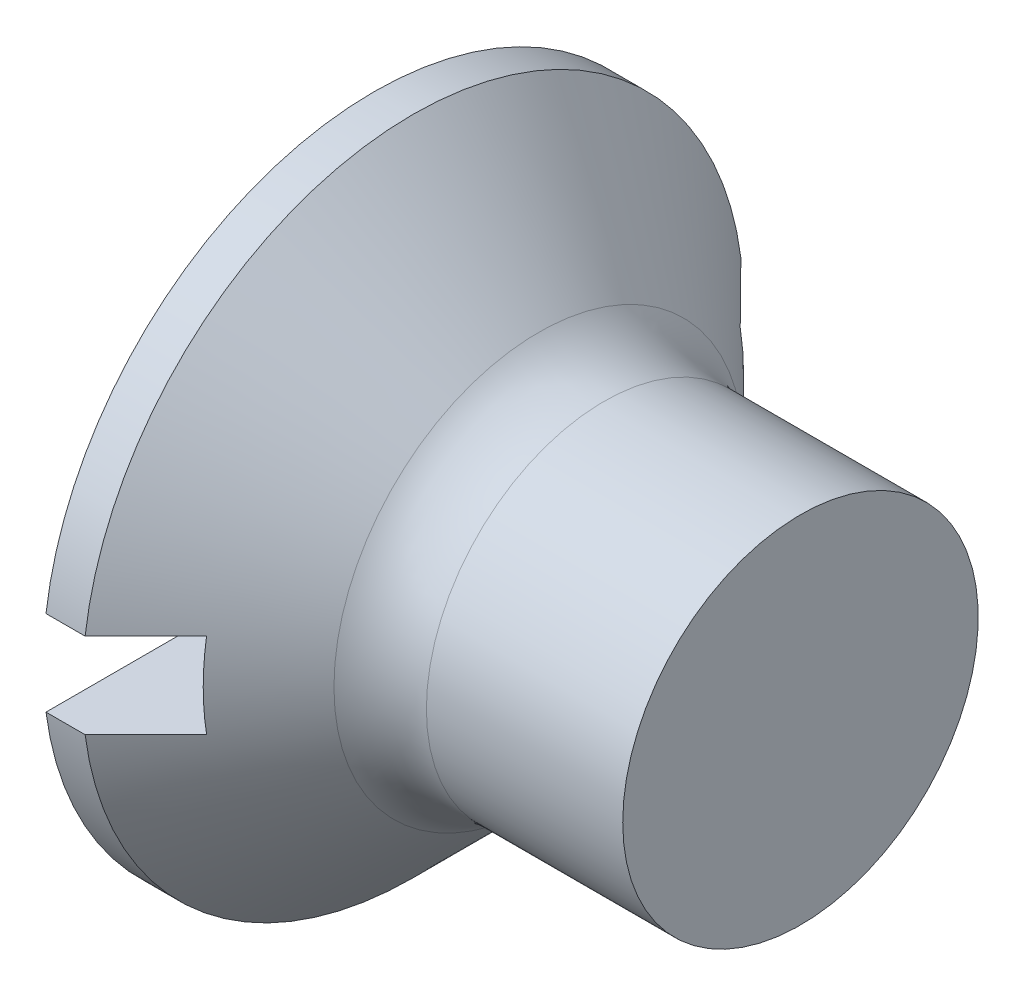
SolidWorks part; units mm, degrees
ref_plane "Plane1" through (0, 0, 0) normal (0, 0, 1) x (1, 0, 0)
ref_plane "Plane2" through (0, 0, 0) normal (0, 1, 0) x (1, 0, 0)
ref_plane "Plane3" through (0, 0, 0) normal (1, 0, 0) x (0, 0, -1)
sketch "BodySke" plane through (0, 0, 0) normal (0, 0, 1) x (1, 0, 0)
  line L0 (0, 0) -> (0, 4.65)
  line L1 (0, 4.65) -> (0.55, 4.65)
  line L2 (2.7, 2.5) -> (6, 2.5)
  line L3 (6, 2.5) -> (6, 0)
  line L4 (6, 0) -> (0, 0)
  line L5 (-6.35, 0) -> (82.55, 0) construction
  line L6 (2.7, -2.5) -> (6, -2.5) construction
  line L7 (0.55, -4.65) -> (2.7, -2.5) construction
  line L8 (0.55, 4.65) -> (2.7, 2.5)
  line L9 (0, -4.65) -> (0.55, -4.65) construction
  line L10 (3.5, 4.0875) -> (3.5, -5.4375) construction
  line L11 (-2, 6.35) -> (-2, -3.175) construction
  dimension "Diameter" = 5
  dimension "Length" = 6
  dimension "Head_ht" = 2.7
  dimension "Head_dia" = 9.3
  dimension "Head_ang" = 90
  dimension "D6" = 0.55
  dimension "Advance" = 0.8
  dimension "Thread_nom" = 8
revolve "Base-Revolve" add sketch "BodySke" angle 360 about L5
fillet "Fillet1" radius 1.3 1 edges at (2.7, 0, 2.5)
sketch "Sketch2" plane through (0, 0, 0) normal (-1, 0, 0) x (0, 0, 1)
  line L0 (-4.65, -0.6) -> (4.65, -0.6)
  line L1 (-4.65, -0.6) -> (-4.65, 0.6)
  line L2 (4.65, 0.6) -> (-4.65, 0.6)
  line L3 (4.65, 0.6) -> (4.65, -0.6)
  dimension "D1" = 0.6
  dimension "Slot_width" = 1.2
  dimension "D2" = 9.3
  dimension "D3" = 4.65
extrude "Slot" cut sketch "Sketch2" against normal blind 1.4
sketch "ThdSchSke" plane through (0, 0, 0) normal (0, 0, 1) x (1, 0, 0)
  line L0 (3.5, -2.055) -> (3.1884, -2.5)
  line L1 (3.5, -2.055) -> (3.8116, -2.5)
  line L2 (3.8116, -2.5) -> (3.8116, -3.125)
  line L3 (-3.175, 0) -> (5.1513, 0) construction
  line L5 (3.8116, -3.125) -> (3.1884, -3.125)
  line L6 (3.1884, -3.125) -> (3.1884, -2.5)
  line L7 (0, 4.65) -> (0, 0.6) construction
  dimension "Thread_minor" = 4.11
  dimension "Diameter" = 5
  dimension "Start" = 3.5
  dimension "SideAngle" = 55
  dimension "VeeAngle" = 70
  dimension "Overcut" = 6.25
revolve "ThreadSchematic" [suppressed] cut sketch "ThdSchSke" angle 360 about L3
pattern_linear "ThdSchPat" [suppressed]
equation "\"D1@Sketch2\" = \"Slot_width@Sketch2\" / 2"
equation "\"D2@Sketch2\" = \"Head_dia@BodySke\""
equation "\"D3@Sketch2\" = \"D2@Sketch2\" / 2"
equation "\"Thread_length@ThreadCosmetic\" = ((sgn( (\"Length@BodySke\" - \"Advance@BodySke\" * 1.0 - \"Head_ht@BodySke\" ) - \"Thread_nom@BodySke\" )-1)*( (\"Length@BodySke\" - \"Advance@BodySke\" * 1.0 - \"Head_ht@BodySke\" "
equation "\"Thread_minor@ThdSchSke\" = \"Thread_minor@ThreadCosmetic\""
equation "\"Diameter@ThdSchSke\" = \"Diameter@BodySke\""
equation "\"Overcut@ThdSchSke\" = \"Diameter@BodySke\" * 1.25"
equation "\"Start@ThdSchSke\" = 0.000001 + \"Length@BodySke\" - \"Thread_length@ThreadCosmetic\"  '---Countersunk---"
equation "\"Num_threads@ThdSchPat\" = int( \"Thread_length@ThreadCosmetic\" / \"Advance@BodySke\" + 0.999 )  + 1"
equation "\"Advance@ThdSchPat\" = \"Thread_length@ThreadCosmetic\" /  (\"Num_threads@ThdSchPat\" - 1) 'relax it"
